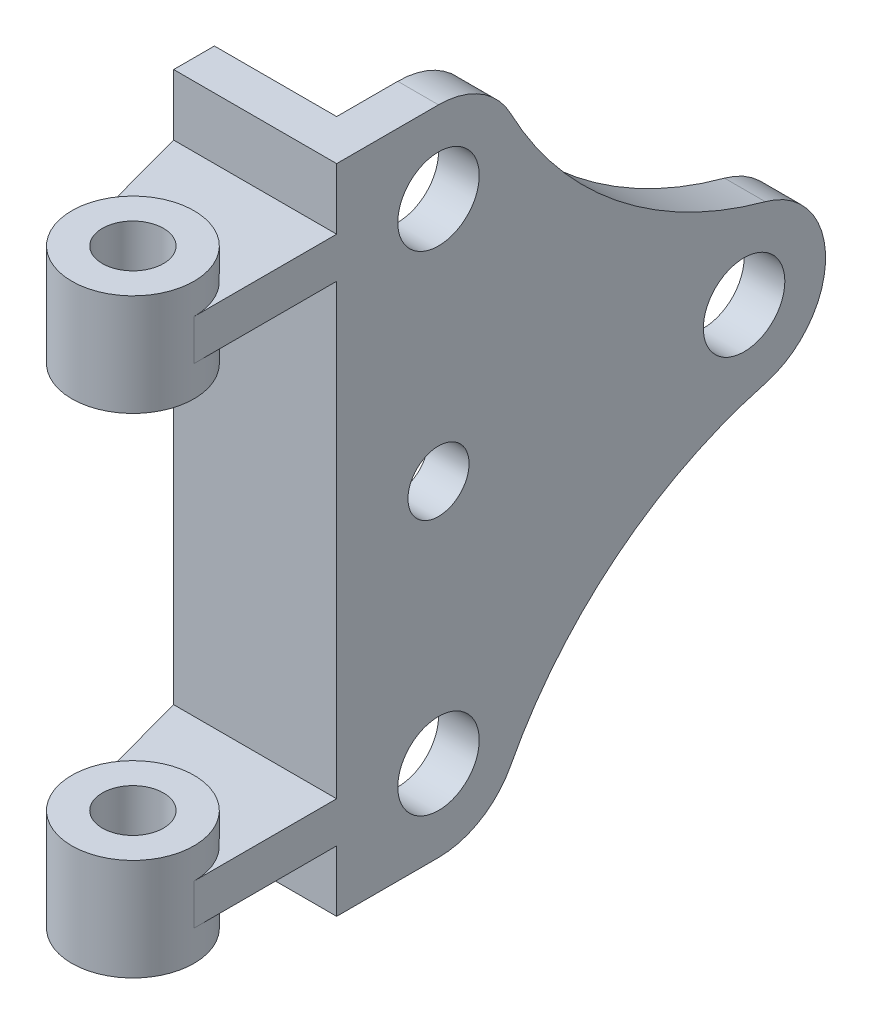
SolidWorks part; units mm, degrees
ref_plane "Plane1" through (0, 0, 0) normal (0, 0, 1) x (1, 0, 0)
ref_plane "Plane2" through (0, 0, 0) normal (0, 1, 0) x (1, 0, 0)
ref_plane "Plane3" through (0, 0, 0) normal (1, 0, 0) x (0, 0, -1)
sketch "Sketch2" plane through (0, 0, 0) normal (1, 0, 0) x (0, 0, -1)
  line L0 (0, 0) -> (0, 101.6)
  line L1 (0, 0) -> (15.875, 0)
  line L2 (0, 50.8) -> (-20.5162, 50.8) construction
  line L3 (0, 101.6) -> (15.875, 101.6)
  arc A0 (66.8019, 63.0633) -> (66.8019, 38.5367) centre (63.5, 50.8) cw
  arc A1 (15.875, 0) -> (27.1144, 6.7867) centre (15.875, 12.7) ccw
  arc A2 (27.1144, 6.7867) -> (66.8019, 38.5367) centre (83.3112, -22.7796) cw
  arc A3 (27.1144, 94.8133) -> (66.8019, 63.0633) centre (83.3112, 124.3796) ccw
  arc A4 (15.875, 101.6) -> (27.1144, 94.8133) centre (15.875, 88.9) cw
  dimension "D1" = 12.7
  dimension "D2" = 12.7
  dimension "D3" = 63.5
  dimension "D6" = 15.875
  dimension "D4" = 101.6
  dimension "D5" = 63.5
extrude "Base-Extrude" add sketch "Sketch2" along normal blind 6.35
sketch "Sketch4" plane through (6.35, 0, 0) normal (1, 0, 0) x (0, 0, -1)
  circle A0 centre (63.5, 50.8) radius 6.35
  circle A1 centre (15.875, 88.9) radius 6.35
  circle A2 centre (15.875, 12.7) radius 6.35
  circle A3 centre (15.875, 50.8) radius 4.7625
  dimension "D1" = 12.7
  dimension "D2" = 9.525
extrude "Cut-Extrude1" cut sketch "Sketch4" against normal through all
sketch "Sketch3" plane through (0, 0, 0) normal (0, 0, 1) x (1, 0, 0)
  line L0 (6.35, 101.6) -> (6.35, 0) construction
  line L1 (6.35, 0) -> (-19.05, 0)
  line L2 (6.35, 0) -> (6.35, 101.6)
  line L3 (6.35, 101.6) -> (-19.05, 101.6)
  line L4 (-19.05, 0) -> (-19.05, 101.6)
  line L5 (6.35, 101.6) -> (0, 101.6) construction
  line L6 (6.35, 0) -> (0, 0) construction
  dimension "D1" = 25.4
extrude "Boss-Extrude1" add sketch "Sketch3" against normal blind 6.35
ref_plane "Plane4" through (0, 88.9, 0) normal (0, 1, 0) x (-1, 0, 0)
sketch "Sketch5" plane through (0, 88.9, 0) normal (0, 1, 0) x (-1, 0, 0)
  line L0 (-6.35, 0) -> (19.05, 0) construction
  line L1 (19.05, 0) -> (-6.35, 0)
  line L2 (12.3699, 24.7107) -> (19.05, 0)
  line L3 (0, -6.35) -> (19.05, -6.35) construction
  line L4 (-6.35, 0) -> (-6.35, 22.225)
  line L5 (-6.35, -15.875) -> (-6.35, 0) construction
  arc A0 (-6.35, 22.225) -> (12.3699, 24.7107) centre (3.175, 22.225) cw
  dimension "D1" = 19.05
  dimension "D2" = 28.575
extrude "Boss-Extrude2" add sketch "Sketch5" along normal mid plane 6.35
sketch "Sketch6" plane through (0, 88.9, 0) normal (0, 1, 0) x (-1, 0, 0)
  circle A0 centre (3.175, 22.225) radius 9.525
  arc A3 (12.3699, 24.7107) -> (-6.35, 22.225) centre (3.175, 22.225) ccw construction
extrude "Boss-Extrude3" add sketch "Sketch6" along normal mid plane 15.875
sketch "Sketch7" plane through (0, 96.8375, 0) normal (0, 1, 0) x (-1, 0, 0)
  circle A0 centre (3.175, 22.225) radius 4.7625
  dimension "D1" = 9.525
extrude "Cut-Extrude2" cut sketch "Sketch7" against normal through all
fillet "Fillet1" radius 1.5875
fillet "Fillet2" radius 1.5875
ref_plane "Plane5" through (0, 50.8, 0) normal (0, 1, 0) x (-1, 0, 0)
mirror "Mirror2" about plane through (0, 50.8, 0) normal (0, 1, 0) of "Boss-Extrude2", "Boss-Extrude3", "Cut-Extrude2", "Fillet1", "Fillet2"
fillet "Fillet3" radius 1.5875
fillet "Fillet4" radius 1.5875
